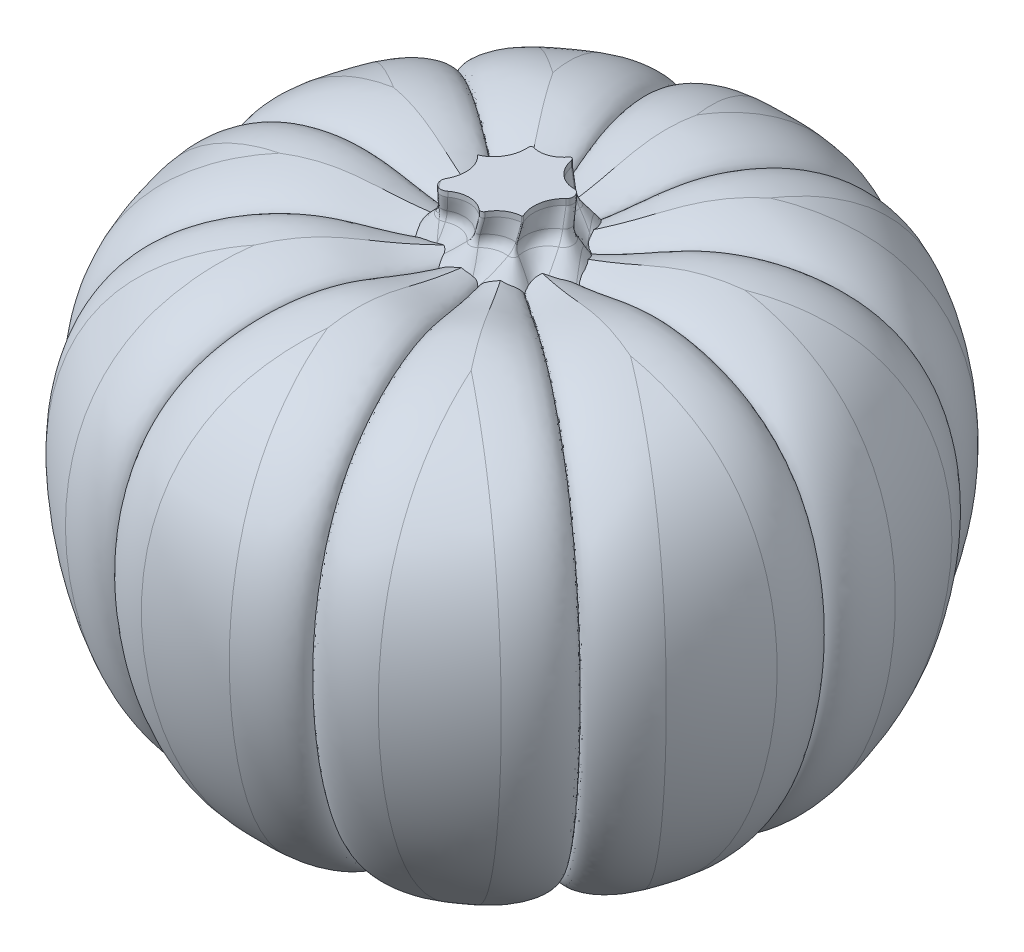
SolidWorks part; units mm, degrees
ref_plane "Front Plane" through (0, 0, 0) normal (0, 0, 1) x (1, 0, 0)
ref_plane "Top Plane" through (0, 0, 0) normal (0, 1, 0) x (1, 0, 0)
ref_plane "Right Plane" through (0, 0, 0) normal (1, 0, 0) x (0, 0, -1)
sketch "Sketch1" plane through (0, 0, 0) normal (0, 0, 1) x (1, 0, 0)
  line L0 (0, 0) -> (0, 84.6121)
  spline S0 degree 3 poles (0, 84.6121) (-0.0752, 87.6422) (-2.1965, 80.8462) (-29.2998, 87.3288) (-59.6462, 78.2149) (-61.2271, 37.1099) (-40.8798, 0.5692) (-11.9352, -2.1339) (0, 0) knots 0 0 0 0 0.217681 0.252692 0.35011 0.582894 0.723743 1 1 1 1
revolve "Revolve1" add sketch "Sketch1" angle 36 about L0
fillet "Fillet1" radius 10 2 edges
pattern_circular "CirPattern1" count 10 over 360
combine bodies "Combine1" bodies to combine 103 110 107 104 102 108 105 109 106 116
ref_plane "Plane1" through (0, 81, 0) normal (0, 1, 0) x (1, 0, 0)
sketch "Sketch2" plane through (0, 81, 0) normal (0, 1, 0) x (1, 0, 0)
  arc A0 (-0.377, 11.7354) -> (-6.9704, 8.7675) centre (-2.6475, 7.9717) ccw
  arc A2 (7.5768, 7.708) -> (0.6779, 11.7489) centre (3.0949, 7.9657) ccw
  arc A3 (-7.9175, 7.9492) -> (-11.0961, 1.4319) centre (-7.7678, 3.8424) ccw
  arc A4 (-11.1703, 0.168) -> (-4.8849, -8.9344) centre (-6.9991, -3.673) ccw
  arc A5 (-3.7403, -9.2264) -> (3.3791, -9.2634) centre (-0.1652, -6.2811) ccw
  arc A6 (4.2629, -8.9143) -> (8.8145, -3.7013) centre (4.7598, -4.7546) ccw
  arc A7 (9.329, -2.5586) -> (8.8145, -3.7013) centre (9.7824, -3.4498) ccw
  arc A8 (4.2629, -8.9143) -> (3.3791, -9.2634) centre (4.1443, -9.9072) ccw
  arc A9 (-3.7403, -9.2264) -> (-4.8849, -8.9344) centre (-4.5121, -9.8623) ccw
  arc A10 (-11.1703, 0.168) -> (-11.0961, 1.4319) centre (-11.906, 0.8454) ccw
  arc A11 (-7.9175, 7.9492) -> (-6.9704, 8.7675) centre (-7.9539, 8.9485) ccw
  arc A12 (9.329, -2.5586) -> (7.9789, 7.1889) centre (6.9681, 2.0817) ccw
  arc A13 (-0.377, 11.7354) -> (0.6779, 11.7489) centre (0.1396, 12.5916) ccw
  arc A14 (7.5768, 7.708) -> (7.9789, 7.1889) centre (8.076, 7.6793) ccw
  dimension "D1" = 1
  dimension "D2" = 0.5
extrude "Boss-Extrude2" add sketch "Sketch2" along normal blind 5 draft 39 separate body
sketch "Sketch3" plane through (0, 86, 0) normal (0, 1, 0) x (1, 0, 0)
  arc A14 (7.4929, 1.0501) -> (7.1928, 3.217) centre (6.9681, 2.0817) ccw
  arc A15 (3.5346, 7.9405) -> (7.1928, 3.217) centre (8.076, 7.6793) ccw
  arc A16 (3.5346, 7.9405) -> (2.8578, 8.3369) centre (3.0949, 7.9657) ccw
  arc A17 (-2.4685, 8.2685) -> (2.8578, 8.3369) centre (0.1396, 12.5916) ccw
  arc A18 (-2.4685, 8.2685) -> (-2.9884, 8.0344) centre (-2.6475, 7.9717) ccw
  arc A19 (-7.77, 3.9029) -> (-2.9884, 8.0344) centre (-7.9539, 8.9485) ccw
  arc A20 (-7.77, 3.9029) -> (-7.8168, 3.8069) centre (-7.7678, 3.8424) ccw
  arc A21 (-8.1918, -2.5747) -> (-7.8168, 3.8069) centre (-11.906, 0.8454) ccw
  arc A22 (-8.1918, -2.5747) -> (-6.3945, -5.1774) centre (-6.9991, -3.673) ccw
  arc A23 (-0.6153, -6.6519) -> (-6.3945, -5.1774) centre (-4.5121, -9.8623) ccw
  arc A24 (-0.6153, -6.6519) -> (0.281, -6.6566) centre (-0.1652, -6.2811) ccw
  arc A25 (4.7432, -4.8939) -> (0.281, -6.6566) centre (4.1443, -9.9072) ccw
  arc A27 (7.4929, 1.0501) -> (4.8957, -4.7193) centre (9.7824, -3.4498) ccw
  arc A28 (7.4929, 1.0501) -> (7.1928, 3.217) centre (6.9681, 2.0817) ccw
  arc A29 (3.5346, 7.9405) -> (7.1928, 3.217) centre (8.076, 7.6793) ccw
  arc A30 (3.5346, 7.9405) -> (2.8578, 8.3369) centre (3.0949, 7.9657) ccw
  arc A31 (-2.4685, 8.2685) -> (2.8578, 8.3369) centre (0.1396, 12.5916) ccw
  arc A32 (-2.4685, 8.2685) -> (-2.9884, 8.0344) centre (-2.6475, 7.9717) ccw
  arc A33 (-7.77, 3.9029) -> (-2.9884, 8.0344) centre (-7.9539, 8.9485) ccw
  arc A35 (-8.1918, -2.5747) -> (-7.8168, 3.8069) centre (-11.906, 0.8454) ccw
  arc A36 (-8.1918, -2.5747) -> (-6.3945, -5.1774) centre (-6.9991, -3.673) ccw
  arc A37 (-0.6153, -6.6519) -> (-6.3945, -5.1774) centre (-4.5121, -9.8623) ccw
  arc A38 (-0.6153, -6.6519) -> (0.281, -6.6566) centre (-0.1652, -6.2811) ccw
  arc A39 (4.7432, -4.8939) -> (0.281, -6.6566) centre (4.1443, -9.9072) ccw
  arc A41 (7.4929, 1.0501) -> (4.8957, -4.7193) centre (9.7824, -3.4498) ccw
  arc A42 (-7.77, 3.9029) -> (-7.8168, 3.8069) centre (-7.7678, 3.8424) ccw
  arc A44 (4.7432, -4.8939) -> (4.8957, -4.7193) centre (4.7598, -4.7546) ccw
  arc A45 (4.7432, -4.8939) -> (4.8957, -4.7193) centre (4.7598, -4.7546) ccw
  dimension "D1" = 0
extrude "Boss-Extrude3" add sketch "Sketch3" along normal blind 5
fillet "Fillet2" radius 3 14 edges at (-8.3333, 86, 4.5943) (-6.8657, 86, -0.5492) (-7.8222, 86, -3.869) (-4.6529, 86, -5.1281) (-2.7898, 86, -8.2877) (0.2044, 86, -7.5431) (3.3175, 86, -8.3458) (4.4796, 86, -4.894) (8.1145, 86, -2.2404) (5.1785, 86, 1.3773) (4.8656, 86, 4.8469) (2.2894, 86, 5.2114) (-0.1682, 86, 6.8643) (-3.2639, 86, 4.9701)
other "Flex1" parameters "D0"=20, "D1"=0, "D2"=0
other "Flex2" parameters "D0"=11.459, "D1"=4.1695, "D2"=2.6433
